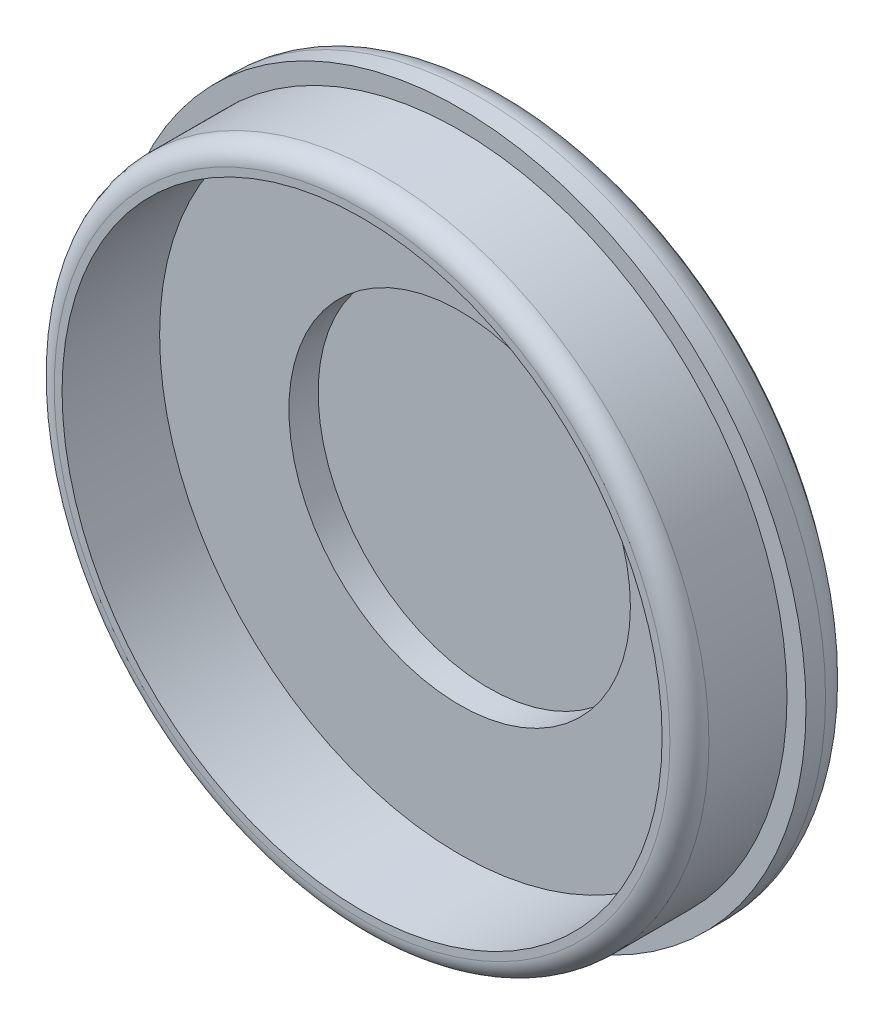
SolidWorks part; units mm, degrees
ref_plane "Front Plane" through (0, 0, 0) normal (0, 0, 1) x (1, 0, 0)
ref_plane "Top Plane" through (0, 0, 0) normal (0, 1, 0) x (1, 0, 0)
ref_plane "Right Plane" through (0, 0, 0) normal (1, 0, 0) x (0, 0, -1)
sketch "Sketch1" plane through (0, 0, 0) normal (0, 0, 1) x (1, 0, 0)
  circle A0 centre (0, 0) radius 35.5
  dimension "D1" = 71
extrude "Boss-Extrude1" add sketch "Sketch1" along normal blind 5
fillet "Fillet1" radius 3 1 edges at (35.5, 0, 0)
sketch "Sketch2" plane through (0, 0, 0) normal (0, 0, 1) x (1, 0, 0)
  circle A0 centre (0, 0) radius 33.55
  circle A1 centre (0, 0) radius 30.75
  dimension "D1" = 67.1
  dimension "D2" = 61.5
extrude "Boss-Extrude2" add sketch "Sketch2" along normal blind 15
fillet "Fillet2" radius 2 1 edges at (33.55, 0, 15)
sketch "Sketch3" plane through (0, 0, 0) normal (0, 0, 1) x (1, 0, 0)
  circle A1 centre (0, 0) radius 31.55
  dimension "D1" = 63.1
extrude "Boss-Extrude3" add sketch "Sketch3" along normal blind 5
hole_wizard "Hole1" positions "Sketch6" profile "Sketch5" legacy
sketch "Sketch6" plane through (0, 0, 5) normal (0, 0, 1) x (1, 0, 0)
  point P0 (0, 0)
sketch "Sketch5" plane through (0, 0, 5) normal (1, 0, 0) x (0, -1, 0)
  line L0 (0, 0) -> (0, 3)
  line L1 (0, 3) -> (17.5, 3)
  line L2 (17.5, 3) -> (17.5, 0)
  line L3 (17.5, 0) -> (0, 0)
  line L4 (0, 110) -> (0, -10) construction
  dimension "Diameter" = 35
  dimension "Depth" = 3
